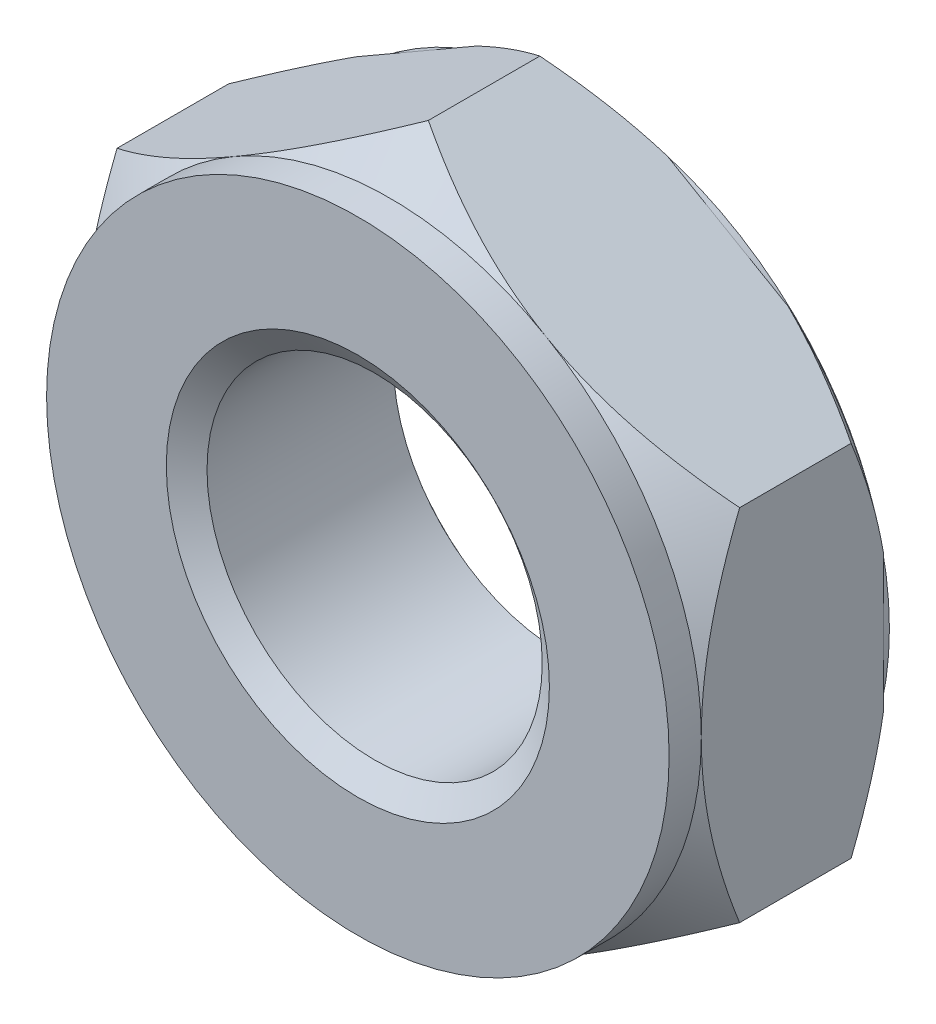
SolidWorks part; units mm, degrees
ref_plane "Plane1" through (0, 0, 0) normal (0, 0, 1) x (1, 0, 0)
ref_plane "Plane2" through (0, 0, 0) normal (0, 1, 0) x (1, 0, 0)
ref_plane "Plane3" through (0, 0, 0) normal (1, 0, 0) x (0, 0, -1)
revolve "EndChamfer" cut sketch "EndChamferSke" angle 360 about L11
sketch "EndChamferSke" plane through (0, 0, 0) normal (1, 0, 0) x (0, 0, -1)
  line L0 (14.5796, 12.7) -> (13.3569, 10.9538)
  line L1 (14.6304, 12.7) -> (14.5796, 12.7)
  line L2 (14.6304, 12.7) -> (14.6304, 10.9538)
  line L3 (14.6304, 10.9538) -> (13.3569, 10.9538)
  line L6 (-0.0508, 12.7) -> (0, 12.7)
  line L7 (0, 12.7) -> (1.2227, 10.9538)
  line L9 (1.2227, 10.9538) -> (-0.0508, 10.9538)
  line L10 (-0.0508, 10.9538) -> (-0.0508, 12.7)
  line L11 (25.0375, 0) -> (38.388, 0) construction
  dimension "D1" = 35
  dimension "D2" = 0.0508
  dimension "Offset1" = 14.6304
  dimension "ThreadMajor" = 12.7
  dimension "ChamferDepth" = 1.7463
  dimension "Offset2" = 14.6812
extrude "BaseNut" add sketch "BaseNutSke" against normal blind 14.605
sketch "BaseNutSke" plane through (0, 0, 0) normal (0, 0, 1) x (1, 0, 0)
  line L6 (20.6375, 11.9151) -> (20.6375, -11.9151)
  line L7 (-20.6375, 11.9151) -> (-20.6375, -11.9151)
  line L8 (20.6375, 11.9151) -> (0, 23.8301)
  line L9 (0, 23.8301) -> (-20.6375, 11.9151)
  line L10 (-20.6375, -11.9151) -> (0, -23.8301)
  line L11 (0, -23.8301) -> (20.6375, -11.9151)
  circle A0 centre (0, 0) radius 11.1125
  dimension "D4" = 20.6375
  dimension "Thread_min" = 22.225
  dimension "D1" = 120
  dimension "D2" = 20.6375
  dimension "D3" = 20.6375
  dimension "Width_flats" = 41.275
sketch "Sketch4" plane through (0, 0, 0) normal (1, 0, 0) x (0, 0, -1)
  line L0 (14.605, 20.6375) -> (14.1986, 20.6375)
  line L1 (14.605, 20.6375) -> (14.605, 36.5301)
  line L2 (14.1986, 36.5301) -> (14.605, 36.5301)
  line L3 (14.1986, 36.5301) -> (14.1986, 20.6375)
  line L4 (0, 0) -> (34.925, 0) construction
  line L6 (14.605, 11.9151) -> (14.605, 23.8301) construction
  line L7 (0, 20.6375) -> (-12.7, 20.6375)
  line L8 (0, 11.9151) -> (0, 23.8301) construction
  line L9 (2.54, 23.8301) -> (2.54, 36.5301)
  line L10 (2.54, 36.5301) -> (-12.7, 36.5301)
  line L11 (-12.7, 36.5301) -> (-12.7, 20.6375)
  line L12 (0, 20.6375) -> (2.54, 23.8301)
  line L14 (0, 11.9151) -> (0, -11.9151) construction
  line L15 (14.605, 23.8301) -> (0, 23.8301) construction
  dimension "D1" = 20.6375
  dimension "D2" = 2.54
  dimension "Bearing_ht" = 0.4064
  dimension "D3" = 12.7
  dimension "D4" = 12.7
revolve "Bearing-Face" cut sketch "Sketch4" angle 360 about L4
sketch "Sketch3" plane through (0, 0, 0) normal (1, 0, 0) x (0, 0, -1)
  line L0 (14.605, 20.6375) -> (12.065, 23.8301)
  line L1 (12.065, 23.8301) -> (12.065, 36.5301)
  line L2 (12.065, 36.5301) -> (27.305, 36.5301)
  line L3 (27.305, 36.5301) -> (27.305, 20.6375)
  line L4 (27.305, 20.6375) -> (14.605, 20.6375)
  line L5 (14.605, 11.9151) -> (14.605, 23.8301) construction
  line L6 (14.1986, 23.8301) -> (2.54, 23.8301) construction
  line L7 (0, 0) -> (38.6776, 0) construction
  line L8 (14.605, 0) -> (0, 0) construction
  line L9 (8.3693, 23.8301) -> (8.3693, 44.222) construction
  line L10 (4.6736, 36.5301) -> (-10.5664, 36.5301)
  line L11 (-10.5664, 36.5301) -> (-10.5664, 20.6375)
  line L12 (-10.5664, 20.6375) -> (2.1336, 20.6375)
  line L13 (2.1336, 20.6375) -> (4.6736, 23.8301)
  line L14 (4.6736, 23.8301) -> (4.6736, 36.5301)
  line L16 (14.1986, 23.8301) -> (2.54, 23.8301) construction
  dimension "D1" = 20.6375
  dimension "D2" = 2.54
  dimension "D3" = 12.7
  dimension "D4" = 12.7
revolve "Double-Chamfer" cut sketch "Sketch3" angle 360 about L7
sketch "ThdSchSke" plane through (0, 0, 0) normal (0, 1, 0) x (1, 0, 0)
  line L0 (-12.7, 0.0254) -> (-11.1125, 1.137)
  line L1 (-11.1125, 1.137) -> (-5.5562, 1.137)
  line L2 (-5.5562, 1.137) -> (-5.5562, -1.0862)
  line L3 (-5.5562, -1.0862) -> (-11.1125, -1.0862)
  line L4 (-11.1125, -1.0862) -> (-12.7, 0.0254)
  line L5 (-5.4051, 1.6129) -> (6.35, 1.6129) construction
  line L6 (0, 1.6129) -> (0, -2.9874) construction
  dimension "D1" = 0.0254
  dimension "VeeAngle" = 70
  dimension "SideAngle" = 55
  dimension "OverCut" = 11.1125
  dimension "Advance" = 3.175
  dimension "Thread_major" = 25.4
  dimension "Tap_drill" = 22.225
revolve "ThreadSchematic" [suppressed] cut sketch "ThdSchSke" angle 360 about L6
pattern_linear "ThdSchPat" [suppressed]
equation "\"D2@BaseNutSke\" = \"Width_flats@BaseNutSke\" / 2"
equation "\"D3@BaseNutSke\" = \"Width_flats@BaseNutSke\" / 2"
equation "\"D1@Sketch3\" = \"Width_flats@BaseNutSke\" /2"
equation "\"D2@Sketch3\" = \"Thread_major@ThreadCosmetic\" *.1"
equation "\"D1@Sketch4\" = \"D2@BaseNutSke\""
equation "\"D2@Sketch4\" = \"Thread_major@ThreadCosmetic\" *.10"
equation "\"D4@BaseNutSke\" = \"D3@BaseNutSke\""
equation "\"Thread_major@ThdSchSke\" = \"Thread_major@ThreadCosmetic\""
equation "\"Tap_drill@ThdSchSke\" = \"Thread_min@BaseNutSke\""
equation "\"Overcut@ThdSchSke\" = \"Tap_drill@ThdSchSke\" * 0.5"
equation "\"Num_threads@ThdSchPat\" = int(  ( \"Thickness@BaseNut\" - 0.002 ) / \"Advance@ThdSchSke\" + 0.999 )  + 1"
equation "\"Advance@ThdSchPat\" = ( \"Thickness@BaseNut\" - 0.002 ) /  (\"Num_threads@ThdSchPat\" - 1) 'relax it"
equation "' \"Num_threads@ThdSchPat\" = \"Num_threads@ThdSchPat\" - sgn( \"Num_threads@ThdSchPat\" - 1) '---chamfered tips only---"
equation "\"ThreadMajor@EndChamferSke\" = \"Thread_major@ThreadCosmetic\" * 0.5"
equation "\"ChamferDepth@EndChamferSke\" = (\"Thread_major@ThreadCosmetic\" - \"Thread_min@BaseNutSke\") * 0.55"
equation "\"Offset1@EndChamferSke\" = \"Thickness@BaseNut\" + 0.001"
equation "\"Offset2@EndChamferSke\" = \"Offset1@EndChamferSke\" + 0.002"
